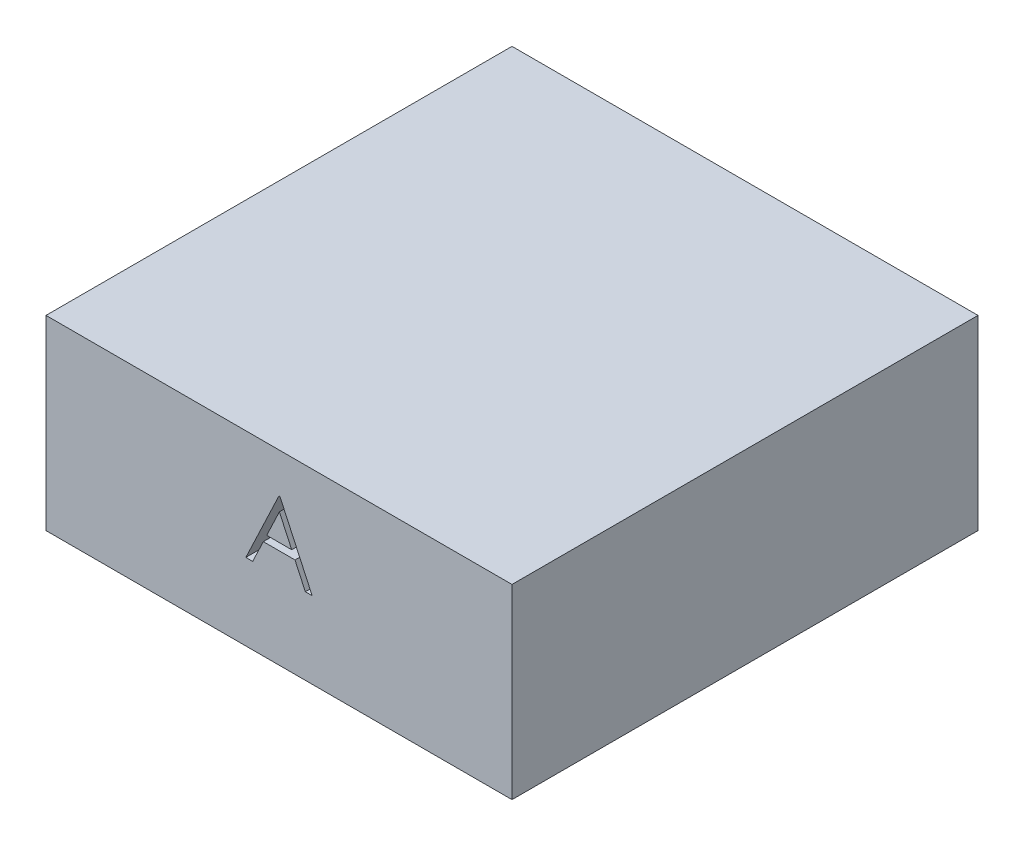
SolidWorks part; units mm, degrees
ref_plane "Front Plane" through (0, 0, 0) normal (0, 0, 1) x (1, 0, 0)
ref_plane "Top Plane" through (0, 0, 0) normal (0, 1, 0) x (1, 0, 0)
ref_plane "Right Plane" through (0, 0, 0) normal (1, 0, 0) x (0, 0, -1)
sketch "Sketch1" plane through (0, 0, 0) normal (0, 0, 1) x (1, 0, 0)
  line L0 (0, 26.5943) -> (0, -26.5943)
  line L1 (0, 0) -> (37.5, 0) construction
  line L2 (37.5, 0) -> (37.5, -44.45) construction
  line L3 (37.5, 0) -> (35.2986, -42.0057) construction
  line L4 (15.6328, -34.0862) -> (18.4385, -26.5943)
  line L5 (18.4385, -26.5943) -> (26.4385, -26.5943)
  line L6 (18.4385, 26.5943) -> (26.4385, 26.5943)
  line L7 (15.6328, 34.0862) -> (18.4385, 26.5943)
  line L8 (8.0848, -36.6181) -> (4.4365, -26.5943)
  line L9 (4.4365, -26.5943) -> (0, -26.5943)
  line L10 (8.0848, 36.6181) -> (4.4365, 26.5943)
  line L11 (4.4365, 26.5943) -> (0, 26.5943)
  arc A0 (8.0848, 36.6181) -> (15.6328, 34.0862) centre (0, 0) cw
  arc A1 (15.6328, -34.0862) -> (8.0848, -36.6181) centre (0, 0) cw
  arc A2 (15.6328, 34.0862) -> (8.0848, 36.6181) centre (0, 0) ccw
  arc A3 (26.4385, 26.5943) -> (26.4385, -26.5943) centre (0, 0) cw
  dimension "D1" = 37.5
  dimension "D2" = 3
  dimension "D3" = 110
  dimension "D4" = 8
  dimension "D5" = 14.002
  dimension "D6" = 4.4365
  dimension "D7" = 10.0238
revolve "Revolve1" add sketch "Sketch1" angle 360 about L0
fillet "Fillet1" radius 1 8 edges at (-18.4385, -26.5943, 0) (-15.6328, -34.0862, 0) (-8.0848, -36.6181, 0) (-4.4365, -26.5943, 0) (-4.4365, 26.5943, 0) (-8.0848, 36.6181, 0) (-15.6328, 34.0862, 0) (-18.4385, 26.5943, 0)
fillet "Fillet2" radius 5 2 edges at (-26.4385, 26.5943, 0) (-26.4385, -26.5943, 0)
sketch "Sketch3" plane through (0, 0, 0) normal (0, 1, 0) x (1, 0, 0)
  line L1 (-50, -50) -> (50, -50)
  line L2 (-50, -50) -> (-50, 50)
  line L3 (-50, 50) -> (50, 50)
  line L4 (50, -50) -> (50, 50)
  line L5 (-50, -50) -> (50, 50) construction
  line L6 (-50, 50) -> (50, -50) construction
  point P0 (0, 0)
  dimension "D1" = 100
extrude "Boss-Extrude1" add sketch "Sketch3" against normal blind 45 separate body
sketch "Sketch5" plane through (0, 0, 0) normal (0, 1, 0) x (1, 0, 0)
  line L1 (-46.9367, 43.073) -> (-37.7783, 43.073)
  line L2 (-46.9367, 43.073) -> (-46.9367, 37.9214)
  line L3 (-46.9367, 37.9214) -> (-37.7783, 37.9214)
  line L4 (-37.7783, 43.073) -> (-37.7783, 37.9214)
  line L5 (-46.9367, 43.073) -> (-37.7783, 37.9214) construction
  line L6 (-46.9367, 37.9214) -> (-37.7783, 43.073) construction
  line L7 (32.9129, 46.3643) -> (43.2161, 46.3643)
  line L8 (32.9129, 46.3643) -> (32.9129, 34.6301)
  line L9 (32.9129, 34.6301) -> (43.2161, 34.6301)
  line L10 (43.2161, 46.3643) -> (43.2161, 34.6301)
  line L11 (32.9129, 46.3643) -> (43.2161, 34.6301) construction
  line L12 (32.9129, 34.6301) -> (43.2161, 46.3643) construction
  line L13 (-45.935, -23.6115) -> (-38.78, -23.6115)
  line L14 (-45.935, -23.6115) -> (-45.935, -44.2178)
  line L15 (-45.935, -44.2178) -> (-38.78, -44.2178)
  line L16 (-38.78, -23.6115) -> (-38.78, -44.2178)
  line L17 (-45.935, -23.6115) -> (-38.78, -44.2178) construction
  line L18 (-45.935, -44.2178) -> (-38.78, -23.6115) construction
  line L19 (38.4938, -32.3405) -> (30.194, -32.3405)
  line L20 (38.4938, -32.3405) -> (38.4938, -41.4989)
  line L21 (38.4938, -41.4989) -> (30.194, -41.4989)
  line L22 (30.194, -32.3405) -> (30.194, -41.4989)
  line L23 (38.4938, -32.3405) -> (30.194, -41.4989) construction
  line L24 (38.4938, -41.4989) -> (30.194, -32.3405) construction
  point P0 (-42.3575, 40.4972)
  point P5 (38.0645, 40.4972)
  point P10 (-42.3575, -33.9146)
  point P15 (34.3439, -36.9197)
extrude "Boss-Extrude2" add sketch "Sketch5" along normal blind 15
sketch "Sketch6" plane through (0, 0, 50) normal (0, 0, 1) x (1, 0, 0)
  line L0 (-29.4275, -25.9559) -> (29.4275, -25.9559) construction
  text T0 "B" font "Century Gothic" height 15
  point P2 (0, -25.9559)
extrude "Cut-Extrude1" cut sketch "Sketch6" against normal blind 5
combine bodies "Combine2" operation type add bodies to combine 101 109
sketch "Sketch7" plane through (0, 0, 0) normal (0, 1, 0) x (1, 0, 0)
  line L1 (-50, 50) -> (50, 50)
  line L2 (-50, 50) -> (-50, -50)
  line L3 (-50, -50) -> (50, -50)
  line L4 (50, 50) -> (50, -50)
extrude "Boss-Extrude3" add sketch "Sketch7" along normal blind 40 separate body
combine bodies "Combine3" operation type subtract main body 111 bodies to subtract 110
sketch "Sketch8" plane through (0, 0, 50) normal (0, 0, 1) x (1, 0, 0)
  line L0 (-29.7452, 16.4615) -> (29.7452, 16.4615) construction
  text T0 "A" font "Century Gothic" height 15
  point P2 (0, 16.4615)
extrude "Cut-Extrude2" cut sketch "Sketch8" against normal blind 5
